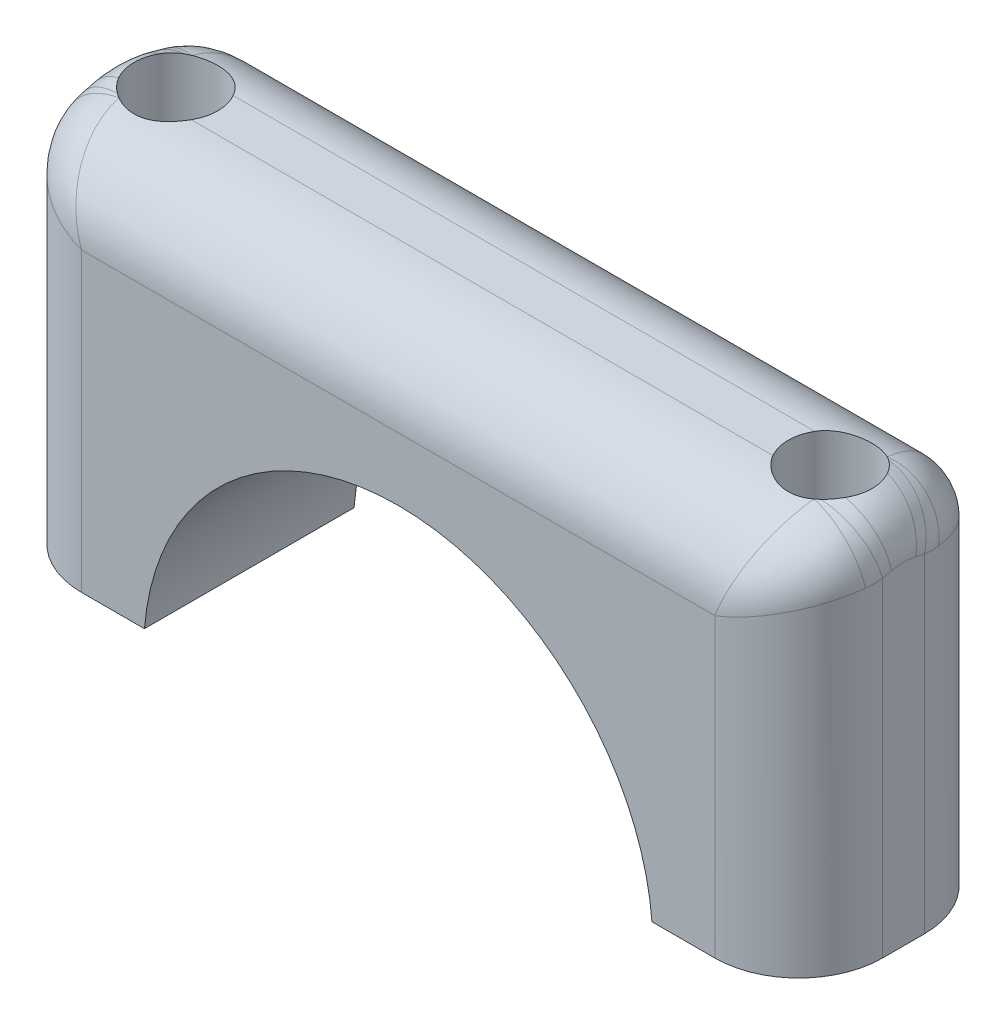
SolidWorks part; units mm, degrees
ref_plane "Front Plane" through (0, 0, 0) normal (0, 0, 1) x (1, 0, 0)
ref_plane "Top Plane" through (0, 0, 0) normal (0, 1, 0) x (1, 0, 0)
ref_plane "Right Plane" through (0, 0, 0) normal (1, 0, 0) x (0, 0, -1)
sketch "Sketch1" plane through (0, 0, 0) normal (0, 0, 1) x (1, 0, 0)
  line L0 (-19.1088, 1) -> (-12.1088, 1)
  line L1 (12.1088, 1) -> (19.1088, 1)
  line L2 (55, 0) -> (-55, 0) construction
  line L3 (0, 12.15) -> (0, 19.15) construction
  line L4 (-19.1088, 1) -> (-19.1088, 19.15)
  line L5 (-19.1088, 19.15) -> (19.1088, 19.15)
  line L6 (19.1088, 19.15) -> (19.1088, 1)
  circle A0 centre (0, 0) radius 12.15 construction
  arc A1 (-12.1088, 1) -> (12.1088, 1) centre (0, 0) cw
  dimension "D1" = 24.3
  dimension "D2" = 1
  dimension "D3" = 7
extrude "Boss-Extrude1" add sketch "Sketch1" along normal mid plane 10
sketch "Sketch2" plane through (0, 1, 0) normal (0, -1, 0) x (1, 0, 0)
  line L0 (-15.6088, 5) -> (-15.6088, -5) construction
  line L1 (-19.1088, 5) -> (-12.1088, 5) construction
  line L2 (-19.1088, -5) -> (-12.1088, -5) construction
  line L3 (15.6088, 5) -> (15.6088, -5) construction
  line L4 (12.1088, 5) -> (19.1088, 5) construction
  line L5 (12.1088, -5) -> (19.1088, -5) construction
  circle A0 centre (-15.6088, 0) radius 2
  circle A1 centre (15.6088, 0) radius 2
  dimension "D1" = 4
extrude "Cut-Extrude1" cut sketch "Sketch2" against normal through all
fillet "Fillet1" radius 4 6 edges at (0, 19.15, -5) (0, 19.15, 5) (19.1088, 10.075, -5) (19.1088, 10.075, 5) (-19.1088, 10.075, -5) (-19.1088, 10.075, 5)
fillet "Fillet2" radius 2.5 4 edges at (17.9372, 17.9784, -3.8284) (-17.9372, 17.9784, -3.8284) (17.9372, 17.9784, 3.8284) (-17.9372, 17.9784, 3.8284)
